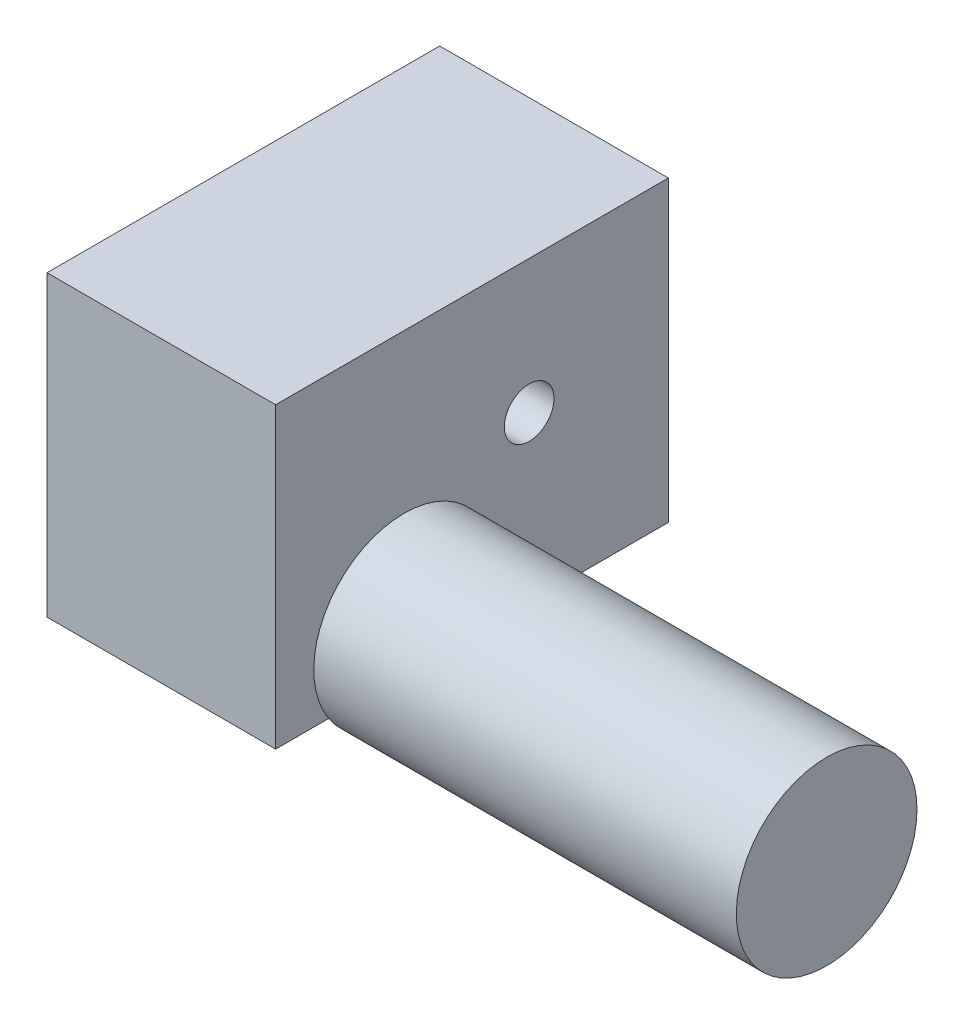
SolidWorks part; units mm, degrees
ref_plane "Front Plane" through (0, 0, 0) normal (1, 0, 0) x (0, 1, 0)
ref_plane "Top Plane" through (0, 0, 0) normal (0, 0, 1) x (0, 1, 0)
ref_plane "Right Plane" through (0, 0, 0) normal (0, 1, 0) x (-1, 0, 0)
sketch "Sketch1" plane through (0, 0, 0) normal (1, 0, 0) x (0, 1, 0)
  line L1 (0, 0) -> (120, 0)
  line L2 (0, 0) -> (0, -158)
  line L3 (0, -158) -> (120, -158)
  line L4 (120, 0) -> (120, -158)
  dimension "D1" = 158
  dimension "D2" = 120
extrude "Boss-Extrude1" add sketch "Sketch1" along normal blind 92
sketch "Sketch2" plane through (92, 0, 0) normal (1, 0, 0) x (0, 1, 0)
  line L1 (120, 0) -> (0, 0) construction
  line L2 (120, -53.0385) -> (136.8, -53.0385)
  line L3 (120, -158) -> (120, 0) construction
  line L4 (100.0099, -15.3398) -> (100.0099, 0)
  circle A0 centre (100.0099, -51.6898) radius 36.35
  dimension "D3" = 72.7
  dimension "D2" = 16.8
extrude "Boss-Extrude2" add sketch "Sketch2" along normal blind 170 contours A0
mirror "Mirror1" about plane through (0, 0, 0) normal (0, 1, 0)
sketch "Sketch4" plane through (0, 120, 0) normal (0, 1, 0) x (-1, 0, 0)
  line L1 (-389.2335, -264.3158) -> (265.7401, -264.3158)
  line L2 (-389.2335, -264.3158) -> (-389.2335, 163.9896)
  line L3 (-389.2335, 163.9896) -> (265.7401, 163.9896)
  line L4 (265.7401, -264.3158) -> (265.7401, 163.9896)
extrude "Cut-Extrude1" cut sketch "Sketch4" against normal up to surface and the other way through all
sketch "Sketch5" plane through (92, 0, 0) normal (1, 0, 0) x (0, 1, 0)
  line L0 (0, -158) -> (-45, -158)
  line L2 (-120, -158) -> (0, -158) construction
  line L5 (-120, -158) -> (-62.5, -158)
  line L6 (-62.5, -158) -> (-45, -158)
  line L7 (-53.75, -158) -> (-53.75, -112)
  circle A3 centre (-53.75, -102) radius 10
  dimension "D3" = 57.5
  dimension "D1" = 20
  dimension "D2" = 45
  dimension "D4" = 46
extrude "Cut-Extrude2" cut sketch "Sketch5" against normal through all contours A3
